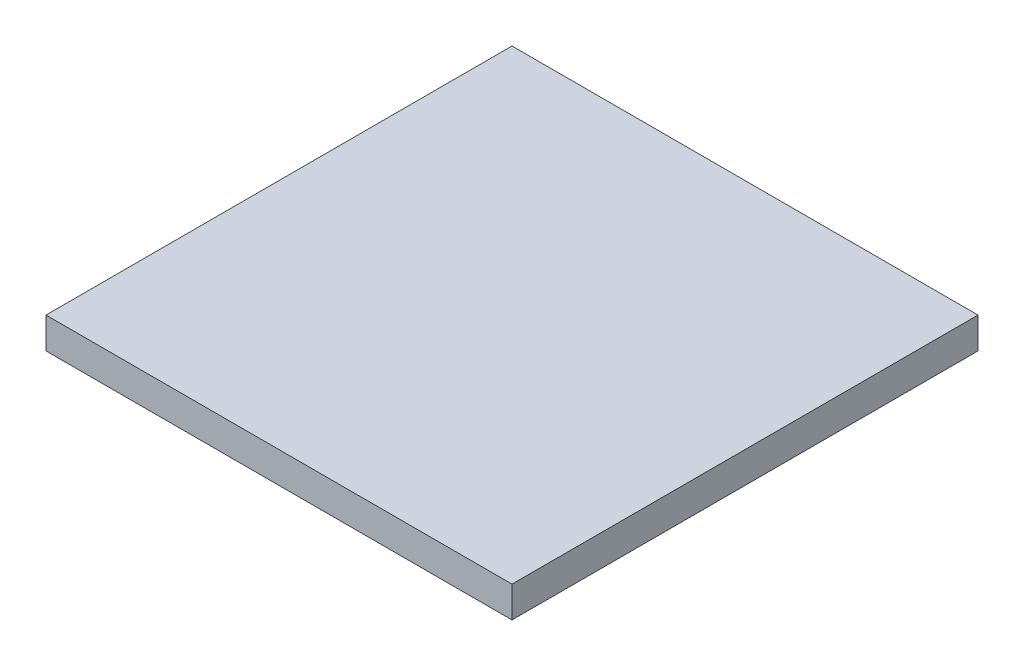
SolidWorks part; units mm, degrees
ref_plane "Plan de face" through (0, 0, 0) normal (0, 0, 1) x (1, 0, 0)
ref_plane "Plan de dessus" through (0, 0, 0) normal (0, 1, 0) x (1, 0, 0)
ref_plane "Plan de droite" through (0, 0, 0) normal (1, 0, 0) x (0, 0, -1)
sketch "Esquisse1" plane through (0, 0, 0) normal (0, 1, 0) x (1, 0, 0)
  line L1 (-75, -75) -> (75, -75)
  line L2 (-75, -75) -> (-75, 75)
  line L3 (-75, 75) -> (75, 75)
  line L4 (75, -75) -> (75, 75)
  line L5 (-75, -75) -> (75, 75) construction
  line L6 (-75, 75) -> (75, -75) construction
  point P0 (0, 0)
  dimension "D1" = 150
  dimension "D2" = 150
extrude "Boss.-Extru.1" add sketch "Esquisse1" against normal blind 10
